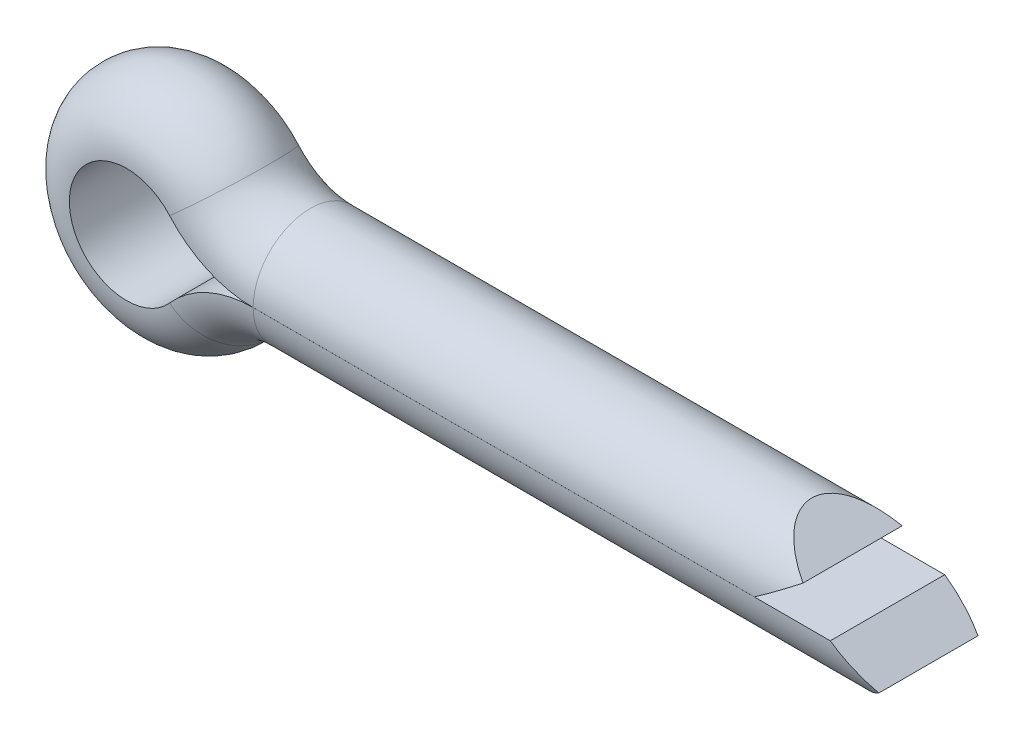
SolidWorks part; units mm, degrees
ref_plane "Front" through (0, 0, 0) normal (0, 0, 1) x (1, 0, 0)
ref_plane "Top" through (0, 0, 0) normal (0, 1, 0) x (1, 0, 0)
ref_plane "Right" through (0, 0, 0) normal (1, 0, 0) x (0, 0, -1)
sketch "PathSke" plane through (0, 0, 0) normal (0, 0, 1) x (1, 0, 0)
  line L0 (45, 4.75) -> (0, 4.75)
  line L1 (0, -4.75) -> (51.3, -4.75)
  line L2 (0, 0) -> (49.7718, 0) construction
  line L3 (0, 0) -> (0, 16.5256) construction
  line L4 (-20, 0) -> (-20, 14.2137) construction
  arc A0 (0, 4.75) -> (-3.3649, 6.2722) centre (0, 9.2303) cw
  arc A1 (-3.3649, 6.2722) -> (-3.3649, -6.2722) centre (-10.5, 0) ccw
  arc A2 (-3.3649, -6.2722) -> (0, -4.75) centre (0, -9.2303) cw
  dimension "Head_dia" = 19
  dimension "Diameter" = 9.5
  dimension "Head_ht" = 20
  dimension "Length" = 45
  dimension "Tip_offset" = 6.3
ref_plane "SectionPlane" through (45, 0, 0) normal (1, 0, 0) x (0, 0, -1)
sketch "SectionSke" plane through (45, 0, 0) normal (1, 0, 0) x (0, 0, -1)
  line L1 (-4.75, 0.002) -> (4.75, 0.002)
  arc A0 (4.75, 0.002) -> (-4.75, 0.002) centre (0, 0) ccw
  dimension "D1" = 0.002
  dimension "Diameter" = 9.5
sweep "Body" add profiles "SectionSke" path "PathSke"
sketch "ConeCutSke" plane through (0, 0, 0) normal (0, 0, 1) x (1, 0, 0)
  line L0 (0, 0) -> (0, 16.2682) construction
  line L1 (0, 0) -> (75.9079, 0) construction
  line L2 (0, 0) -> (51.3, 0) construction
  line L3 (45, 2.376) -> (41.6038, 4.76)
  line L4 (45, 0.002) -> (45, 4.75) construction
  line L6 (45, 2.376) -> (41.5982, 0)
  line L7 (51.3, -2.376) -> (47.8982, 0)
  line L8 (51.3, -4.75) -> (51.3, -0.002) construction
  line L9 (51.3, -2.376) -> (47.9038, -4.76)
  line L10 (47.8982, 0) -> (41.5982, 0)
  line L11 (41.6038, 4.76) -> (51.31, 4.76)
  line L12 (51.31, 4.76) -> (51.31, -4.76)
  line L13 (51.31, -4.76) -> (47.9038, -4.76)
  line L14 (45, 4.75) -> (0, 4.75) construction
  dimension "D1" = 0.01
  dimension "D2" = 0.01
  dimension "D3" = 70
  dimension "D4" = 70
extrude "ConeCut" cut sketch "ConeCutSke" against normal through all and the other way through all
equation "' \"Diameter@PathSke\" = 9.5"
equation "' \"Head_dia@PathSke\" = 19"
equation "' \"Head_ht@PathSke\" = 20"
equation "' \"Tip_offset@PathSke\" = 6.3"
equation "' \"Length@PathSke\" = 45"
equation "' \"Diameter@PathSke\" = 1"
equation "' \"Head_dia@PathSke\" = 2"
equation "' \"Head_ht@PathSke\" = 3"
equation "' \"Tip_offset@PathSke\" = 2.5"
equation "' \"Length@PathSke\" = 8"
equation "' \"Diameter@PathSke\" = 0.5"
equation "' \"Head_dia@PathSke\" = 1"
equation "' \"Head_ht@PathSke\" = 2"
equation "' \"Tip_offset@PathSke\" = 1.6"
equation "' \"Length@PathSke\" = 4"
equation "\"Diameter@SectionSke\" = \"Diameter@PathSke\""
equation "\"Length@SectionPlane\" = \"Length@PathSke\""
